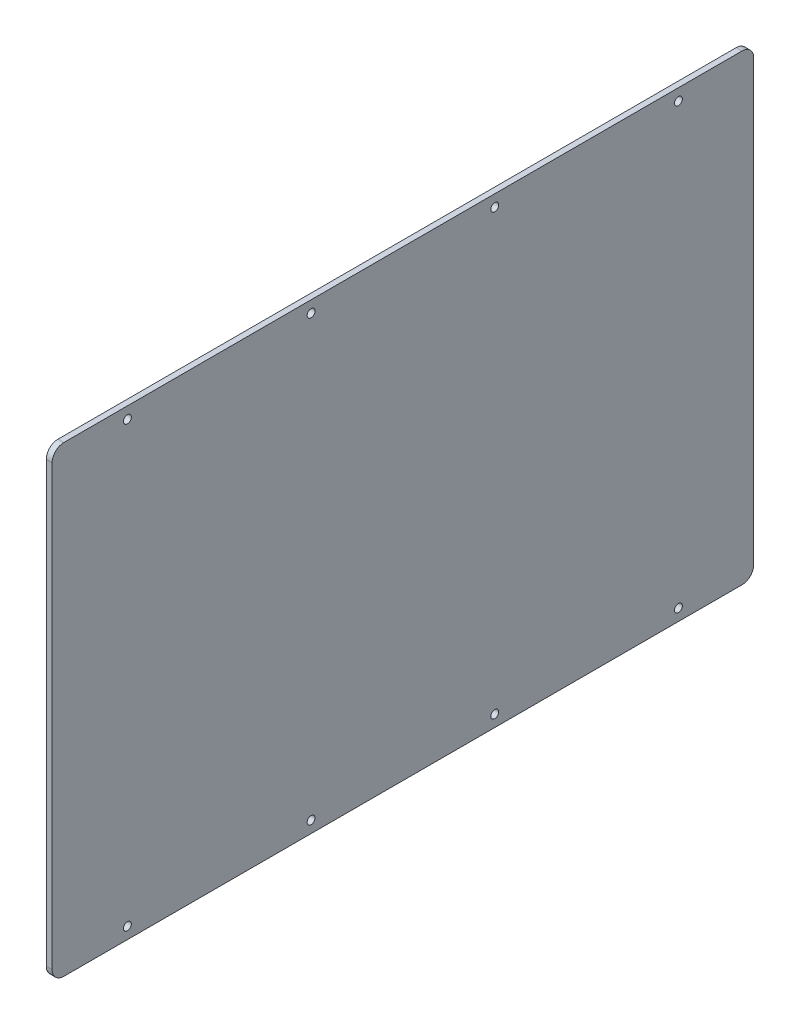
SolidWorks part; units mm, degrees
ref_plane "Front" through (0, 0, 0) normal (0, 0, 1) x (1, 0, 0)
ref_plane "Top" through (0, 0, 0) normal (0, 1, 0) x (1, 0, 0)
ref_plane "Right" through (0, 0, 0) normal (1, 0, 0) x (0, 0, -1)
sketch "Sketch1" plane through (0, 0, 0) normal (1, 0, 0) x (0, 0, -1)
  line L1 (0, -23.114) -> (382, -23.114)
  line L2 (0, -23.114) -> (0, 228.6)
  line L3 (0, 228.6) -> (382, 228.6)
  line L4 (382, -23.114) -> (382, 228.6)
  dimension "D1" = 382
  dimension "D2" = 251.714
  dimension "D3" = 228.6
base flange "Base-Flange1" sketch "Sketch1" thickness 3.175 reverse thickness direction no parameters "D1"=3.175
hole_wizard "7/8 (0.875) Diameter Hole1" positions "Sketch2" profile "Sketch3" hole size "7/8" standard "ANSI Inch"
sketch "Sketch2" plane through (-3.175, 0, 0) normal (-1, 0, 0) x (0, 0, 1)
  line L0 (-100, 58.725) -> (-100, 133.725)
  line L3 (0, -41.275) -> (-435, -41.275) construction
  line L4 (0, 228.6) -> (0, -41.275) construction
  point P0 (-100, 133.725)
  point P2 (-100, 58.725)
  dimension "D1" = 75
  dimension "D2" = 100
  dimension "D3" = 100
sketch "Sketch3" plane through (-3.175, 133.725, -100) normal (0, 1, 0) x (0, 0, 1)
  line L0 (0, 0) -> (0, 3.175)
  line L1 (0, 3.175) -> (11.1125, 3.175)
  line L2 (11.1125, 3.175) -> (11.1125, 0)
  line L5 (11.1125, 0) -> (0, 0)
  line L11 (0, -6.35) -> (0, 107.95) construction
  dimension "Thru Hole Dia." = 22.225
  dimension "Thru Hole Depth" = 3.175
fillet "Fillet1" radius 6.35 4 edges at (-1.5875, -23.114, 0) (-1.5875, -23.114, -382) (-1.5875, 228.6, -382) (-1.5875, 228.6, 0)
hole_wizard "M4 Clearance Hole1" positions "Sketch8" profile "Sketch5" hole size "M4" standard "ANSI Metric"
sketch "Sketch8" plane through (-3.175, 0, 0) normal (-1, 0, 0) x (0, 0, 1)
  line L12 (-341, 222.25) -> (-241, 222.25)
  line L13 (-241, 222.25) -> (-141, 222.25)
  line L14 (-141, 222.25) -> (-41, 222.25)
  line L16 (-41, -16.773) -> (-141, -16.773)
  line L17 (-141, -16.773) -> (-241, -16.773)
  line L18 (-241, -16.773) -> (-341, -16.773)
sketch "Sketch5" plane through (-3.175, 222.25, -341) normal (0, 1, 0) x (0, 0, 1)
  line L0 (0, 0) -> (0, 3.175)
  line L1 (0, 3.175) -> (2.15, 3.175)
  line L2 (2.15, 3.175) -> (2.15, 0)
  line L5 (2.15, 0) -> (0, 0)
  line L11 (0, -6.35) -> (0, 107.95) construction
  dimension "Thru Hole Dia." = 4.3
  dimension "Thru Hole Depth" = 3.175
sketch "Bend-Lines1" [suppressed] plane through (0, 0, 0) normal (0, 1, 0) x (1, 0, 0)
sketch "Bounding-Box1" [suppressed] plane through (0, 0, 0) normal (0, 1, 0) x (1, 0, 0)
sheet metal parameters "Sheet-Metal4" thickness 3.175 parameters "D1"=3.175
flat pattern "Flat-Pattern4"
sketch "Bend-Lines2" plane through (0, 0, 0) normal (0, 1, 0) x (1, 0, 0)
sketch3d "Bounding-Box2" [suppressed]
  line L0 (434.9999, 228.6001, 0) -> (0, 228.6, 0) construction
  line L1 (435, -41.2749, 0) -> (0.0001, -41.275, 0) construction
  line L2 (434.9999, 228.6001, 0) -> (435, -41.2749, 0) construction
  line L3 (0, 228.6, 0) -> (0.0001, -41.275, 0) construction
sheet metal parameters "Sheet-Metal7" thickness 3.175 parameters "D1"=3.175
flat pattern "Flat-Pattern4"
sketch "Bend-Lines2" plane through (0, 0, 0) normal (0, 1, 0) x (1, 0, 0)
sketch3d "Bounding-Box2" [suppressed]
  line L0 (475, -41.275, 0) -> (0, -41.275, 0) construction
  line L1 (475, 228.6, 0) -> (0, 228.6, 0) construction
  line L2 (475, -41.275, 0) -> (475, 228.6, 0) construction
  line L3 (0, -41.275, 0) -> (0, 228.6, 0) construction
sheet metal parameters "Sheet-Metal8" thickness 3.175 parameters "D1"=3.175
flat pattern "Flat-Pattern4"
sketch "Bend-Lines2" plane through (0, 0, 0) normal (0, 1, 0) x (1, 0, 0)
sketch3d "Bounding-Box2" [suppressed]
  line L0 (381.9999, 228.6001, 0) -> (0, 228.6, 0) construction
  line L1 (382, -23.1139, 0) -> (0.0001, -23.114, 0) construction
  line L2 (381.9999, 228.6001, 0) -> (382, -23.1139, 0) construction
  line L3 (0, 228.6, 0) -> (0.0001, -23.114, 0) construction
sketch "Sketch6-1" [suppressed] plane through (-3.175, 0, 0) normal (-1, 0, 0) x (0, 0, 1)
  line L12 (-341, 222.25) -> (-241, 222.25)
  line L13 (-241, 222.25) -> (-141, 222.25)
  line L14 (-141, 222.25) -> (-41, 222.25)
  line L16 (-41, -16.773) -> (-141, -16.773)
  line L17 (-141, -16.773) -> (-241, -16.773)
  line L18 (-241, -16.773) -> (-341, -16.773)
